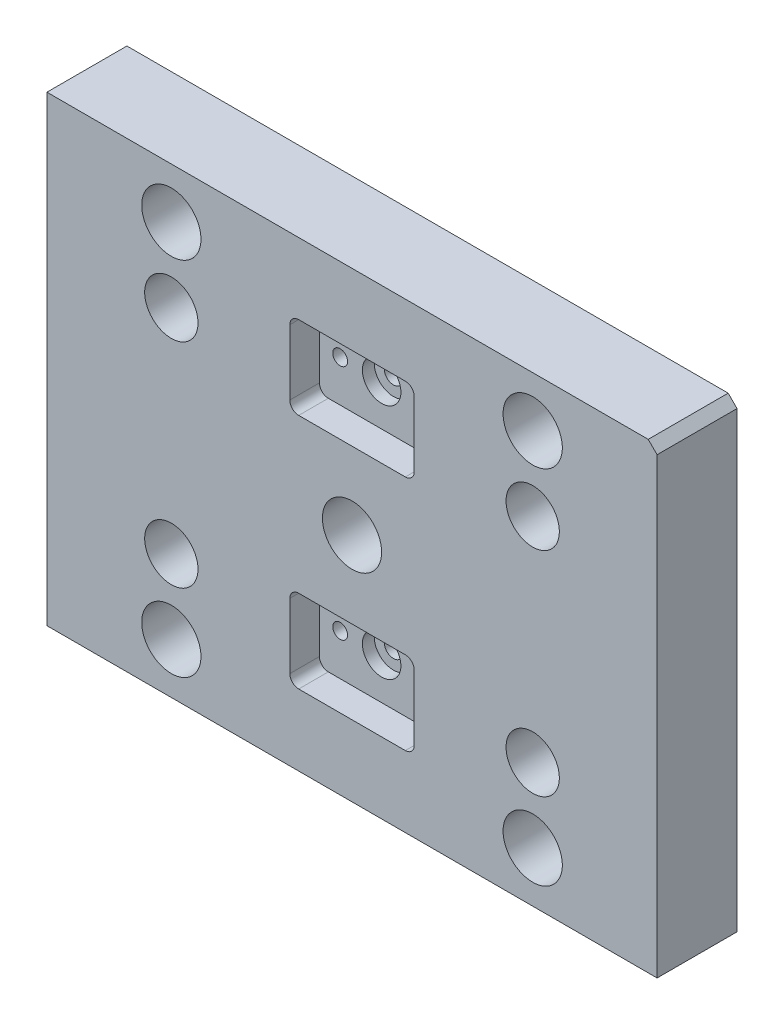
SolidWorks part; units mm, degrees
ref_plane "Plan de face" through (0, 0, 0) normal (0, 0, 1) x (1, 0, 0)
ref_plane "Plan de dessus" through (0, 0, 0) normal (0, 1, 0) x (1, 0, 0)
ref_plane "Plan de droite" through (0, 0, 0) normal (1, 0, 0) x (0, 0, -1)
sketch "Esquisse1" plane through (0, 0, 0) normal (0, 0, 1) x (1, 0, 0)
  line L1 (-103, 78) -> (103, 78)
  line L2 (-103, 78) -> (-103, -78)
  line L3 (-103, -78) -> (103, -78)
  line L4 (103, 78) -> (103, -78)
  point P4 (0, 78)
  point P7 (-103, 0)
  dimension "D1" = 206
  dimension "D2" = 156
extrude "Extrusion1" add sketch "Esquisse1" along normal blind 27
sketch "Esquisse3" plane through (0, 0, 27) normal (0, 0, 1) x (1, 0, 0)
  circle A0 centre (-61, 61) radius 10
  circle A1 centre (-61, 36) radius 5.25
  dimension "D1" = 61
  dimension "D2" = 61
  dimension "D3" = 20
  dimension "D4" = 61
  dimension "D5" = 36
  dimension "D6" = 10.5
extrude "Enlèv. mat.-Extru.1" cut sketch "Esquisse3" against normal through all
sketch "Esquisse13" plane through (0, 0, 27) normal (0, 0, 1) x (1, 0, 0)
  circle A0 centre (-61, 36) radius 9
  dimension "D1" = 18
extrude "Enlèv. mat.-Extru.9" cut sketch "Esquisse13" against normal blind 13
mirror "Symétrie1" about plane through (0, 0, 0) normal (1, 0, 0) of "Enlèv. mat.-Extru.9", "Enlèv. mat.-Extru.1"
mirror "Symétrie2" about plane through (0, 0, 0) normal (0, 1, 0) of "Symétrie1", "Enlèv. mat.-Extru.1", "Enlèv. mat.-Extru.9"
sketch "Esquisse5" plane through (0, 0, 27) normal (0, 0, 1) x (1, 0, 0)
  line L0 (-17.5, 0) -> (-17.5, -24)
  line L1 (17.5, 0) -> (17.5, -24)
  arc A0 (17.5, 0) -> (-17.5, 0) centre (0, 0) ccw
  arc A1 (-17.5, -24) -> (17.5, -24) centre (0, -24) ccw
  dimension "D1" = 17.5
  dimension "D3" = 24
extrude "Passage attelage" [suppressed] cut sketch "Esquisse5" against normal blind 21
sketch "Esquisse8" [suppressed] plane through (0, 0, 6) normal (0, 0, 1) x (1, 0, 0)
  circle A0 centre (0, 0) radius 8
  dimension "D1" = 16
extrude "Enlèv. mat.-Extru.5" [suppressed] cut sketch "Esquisse8" against normal through all
sketch "Esquisse10" plane through (0, 0, 27) normal (0, 0, 1) x (1, 0, 0)
  line L0 (-21, -40) -> (21, -40) construction
  line L1 (-21, -26) -> (21, -26)
  line L2 (-21, -26) -> (-21, -54)
  line L3 (-21, -54) -> (21, -54)
  line L4 (21, -26) -> (21, -54)
  line L5 (0, -26) -> (0, -54) construction
  dimension "D1" = 28
  dimension "D2" = 40
  dimension "D3" = 42
extrude "Enlèv. mat.-Extru.6" cut sketch "Esquisse10" against normal blind 10
fillet "Congé1" radius 3 4 edges at (-21, -54, 22) (21, -54, 22) (21, -26, 22) (-21, -26, 22)
sketch "Esquisse17" plane through (0, 0, 27) normal (0, 0, 1) x (1, 0, 0)
  circle A0 centre (0, 0) radius 10
  dimension "D1" = 20
extrude "Enlèv. mat.-Extru.12" cut sketch "Esquisse17" against normal through all
chamfer "Chanfrein_D" distance 3 angle 45 1 edges at (103, 78, 13.5)
mirror "Symétrie3" about plane through (0, 0, 0) normal (0, 1, 0) of "Enlèv. mat.-Extru.6", "Congé1"
sketch "Esquisse18" plane through (0, 0, 0) normal (0, 0, -1) x (-1, 0, 0)
  line L0 (0, 0) -> (0, -87.6031) construction
  circle A0 centre (0, -40) radius 3.1
  circle A1 centre (0, 40) radius 3.1
  dimension "D2" = 6.2
  dimension "D3" = 40
  dimension "D4" = 40
extrude "Enlèv. mat.-Extru.13" cut sketch "Esquisse18" against normal through all
sketch "Esquisse19" plane through (0, 0, 17) normal (0, 0, 1) x (1, 0, 0)
  circle A0 centre (0, 40) radius 6.5
  circle A1 centre (0, -40) radius 6.5
  dimension "D1" = 13
extrude "Enlèv. mat.-Extru.14" cut sketch "Esquisse19" against normal blind 4
hole_wizard "Trou taraudé M61" positions "Esquisse22" profile "Esquisse21" tap size "M6" standard "ISO"
sketch "Esquisse22" plane through (0, 0, 17) normal (0, 0, 1) x (1, 0, 0)
  line L0 (-6.5, 40) -> (6.5, 40) construction
  line L2 (0, 40) -> (0, 54) construction
  line L3 (-18, 54) -> (18, 54) construction
  circle A0 centre (0, 40) radius 6.5 construction
  point P0 (14, 40)
  point P1 (-14, 40)
  dimension "D1" = 14
  dimension "D2" = 14
sketch "Esquisse21" plane through (14, 40, 17) normal (1, 0, 0) x (0, -1, 0)
  line L0 (0, 0) -> (0, 18.5022)
  line L1 (0, 18.5022) -> (2.5, 17)
  line L2 (2.5, 17) -> (2.5, 0)
  line L5 (2.5, 0) -> (0, 0)
  line L10 (0, 18.5022) -> (-2.5, 17) construction
  line L11 (0, -6.35) -> (0, 107.95) construction
  dimension "Diamètre du trou pour taraudage" = 5
  dimension "Profondeur du trou pour taraudage" = 17
  dimension "Angle de pointe" = 118
mirror "Symétrie4" about plane through (0, 0, 0) normal (0, 1, 0) of "Trou taraudé M61"
